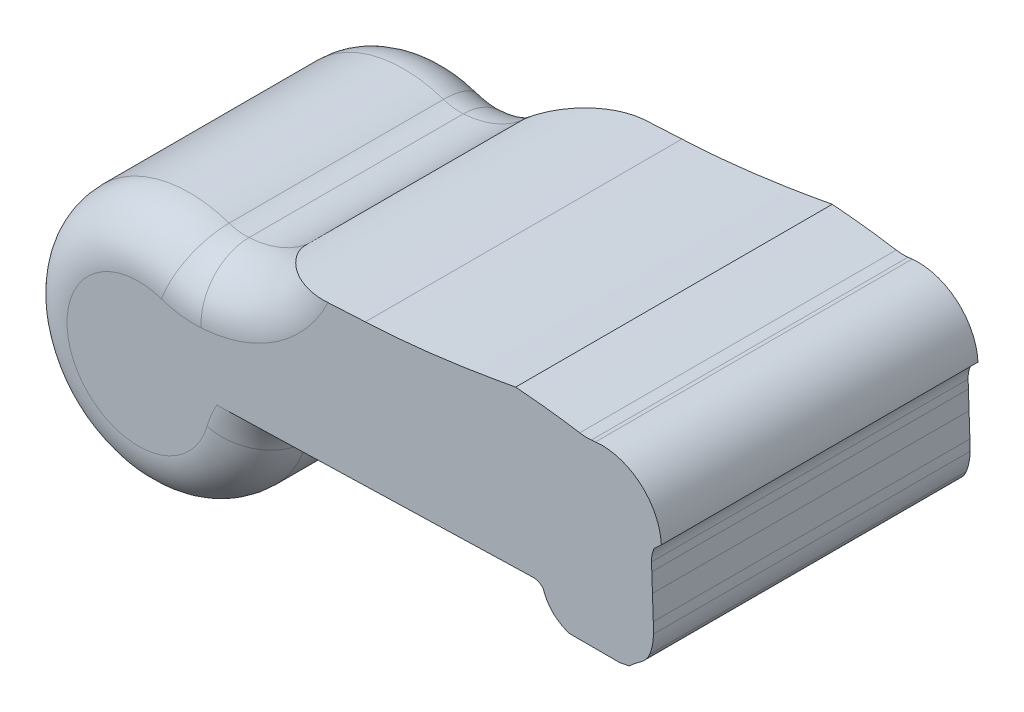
SolidWorks part; units mm, degrees
ref_plane "Front Plane" through (0, 0, 0) normal (0, 0, 1) x (1, 0, 0)
ref_plane "Top Plane" through (0, 0, 0) normal (0, 1, 0) x (1, 0, 0)
ref_plane "Right Plane" through (0, 0, 0) normal (1, 0, 0) x (0, 0, -1)
ref_plane "Plane1" through (0, 0, 7.62) normal (0, 0, 1) x (1, 0, 0)
ref_plane "Plane2" through (0, 0, -228.22) normal (0, 0, -1) x (-1, 0, 0)
sketch "Sketch2" plane through (0, 0, 7.62) normal (0, 0, 1) x (1, 0, 0)
  circle A0 centre (0, 0) radius 91.296
extrude "Extrude1" add sketch "Sketch2" against normal up to surface (235.84 mm away)
sketch "Sketch3" plane through (0, 0, 7.62) normal (0, 0, 1) x (1, 0, 0)
  line L0 (337.4049, 119.4869) -> (340.4943, 119.8116)
  line L1 (125.2878, 4.4564) -> (293.9551, 9.1976)
  line L2 (377.377, -2.3738) -> (378.2104, -1.4436)
  line L7 (382.4039, 56.9698) -> (382.1846, 63.25)
  line L8 (358.444, -13.5754) -> (365.5539, -12.1893)
  line L9 (358.444, -13.5754) -> (321.3285, -13.5754)
  line L10 (383.5078, 25.3591) -> (382.8824, 43.2663)
  line L11 (384.0605, 72.8645) -> (389.5426, 77.8659)
  arc A0 (34.7429, 84.4268) -> (87.2982, 101.526) centre (39.3922, 159.4525) ccw
  arc A1 (34.7429, 84.4268) -> (87.7319, -25.2602) centre (0, 0) cw
  arc A6 (301.4304, 5.8399) -> (293.9551, 9.1976) centre (293.9551, -0.8024) ccw
  arc A10 (125.2878, 4.4564) -> (87.7319, -25.2602) centre (127.2756, -36.6458) ccw
  circle A11 centre (0, 0) radius 91.296 construction
  arc A13 (301.4304, 5.8399) -> (321.3285, -13.5754) centre (329.3425, 14.542) ccw
  ellipse E1 centre (345.0241, 75.4611) end of major axis (374.318, 109.1598) minor radius 44.52 (389.5426, 77.8659) -> (340.4943, 119.8116) ccw
  spline S2 degree 3 poles (169, 111.5051) (174.6177, 111.7605) (180.2194, 112.0931) (188.5979, 112.7004) (191.3882, 112.9209) (196.9545, 113.3961) (199.7269, 113.6504) (205.2499, 114.1903) (208.0004, 114.4759) (213.4785, 115.076) (216.2088, 115.3909) (224.3423, 116.3728) (229.6818, 117.0762) (236.2331, 117.9996) (237.5371, 118.1865) (240.1319, 118.5642) (241.4223, 118.7549) (245.2594, 119.3302) (247.7765, 119.7186) (251.4802, 120.3042) (252.7028, 120.4998) (255.1214, 120.8913) (256.3179, 121.0872) (259.8466, 121.6708) (262.1241, 122.0555) (265.3979, 122.6178) (266.4645, 122.8026) (268.5202, 123.1615) (269.5122, 123.336) (272.3667, 123.8414) (274.1106, 124.1546) (276.0178, 124.5002) (276.3854, 124.567) (277.0901, 124.6952) (277.4275, 124.7568) (278.3752, 124.93) (278.9264, 125.0312) (279.85, 125.2011) (280.2225, 125.2699) (280.6288, 125.345) (280.738, 125.3651) (280.901, 125.3953) (280.9552, 125.4053) (280.9815, 125.4102) knots 0 0 0 0 0.125 0.125 0.1875 0.1875 0.25 0.25 0.3125 0.3125 0.375 0.375 0.5 0.5 0.53125 0.53125 0.5625 0.5625 0.625 0.625 0.65625 0.65625 0.6875 0.6875 0.75 0.75 0.78125 0.78125 0.8125 0.8125 0.875 0.875 0.890625 0.890625 0.90625 0.90625 0.9375 0.9375 0.96875 0.96875 0.984375 0.984375 1 1 1 1
  spline S3 degree 3 poles (87.2982, 101.526) (87.3602, 101.5501) (87.6295, 101.6559) (88.3211, 101.9119) (88.5998, 102.0133) (89.2515, 102.2427) (89.6259, 102.3712) (90.8638, 102.7802) (91.8462, 103.0856) (93.5251, 103.5618) (94.1191, 103.7237) (95.3728, 104.0505) (96.0334, 104.2156) (98.1036, 104.7097) (99.5878, 105.0344) (102.7386, 105.6633) (104.4087, 105.9681) (107.874, 106.5477) (109.6735, 106.8235) (112.4626, 107.217) (113.4084, 107.345) (115.322, 107.5937) (116.29, 107.7145) (119.2256, 108.0668) (121.2249, 108.2882) (125.3006, 108.708) (127.3737, 108.9059) (131.5675, 109.2797) (133.6908, 109.4559) (137.9871, 109.7898) (140.1538, 109.9471) (144.5174, 110.2445) (146.7166, 110.3847) (151.1398, 110.6496) (153.3578, 110.7739) (160.0303, 111.1246) (164.5031, 111.3289) (169, 111.5051) knots 0 0 0 0 0.0625 0.0625 0.09375 0.09375 0.125 0.125 0.1875 0.1875 0.21875 0.21875 0.25 0.25 0.3125 0.3125 0.375 0.375 0.4375 0.4375 0.46875 0.46875 0.5 0.5 0.5625 0.5625 0.625 0.625 0.6875 0.6875 0.75 0.75 0.8125 0.8125 0.875 0.875 1 1 1 1
  spline S5 degree 3 poles (280.9815, 125.4102) (288.9468, 124.7777) (296.906, 124.0156) (312.8089, 122.1621) (320.7527, 121.0727) (328.6856, 119.7533) knots 0 0 0 0 0.5 0.5 1 1 1 1
  spline S14 degree 3 poles (328.6856, 119.7533) (330.1328, 119.5126) (331.5831, 119.3705) (334.4895, 119.281) (335.9457, 119.3336) (337.4049, 119.4869) knots 0 0 0 0 0.5 0.5 1 1 1 1
  spline S15 degree 3 poles (384.0605, 72.8645) (383.9376, 72.5909) (383.8124, 72.2934) (383.567, 71.6662) (383.4463, 71.3354) (383.2123, 70.6391) (383.0991, 70.2735) (382.8841, 69.5057) (382.7819, 69.101) (382.5071, 67.8602) (382.3633, 66.9911) (382.2289, 65.619) (382.1977, 65.1475) (382.1674, 64.2028) (382.1679, 63.7278) (382.1846, 63.25) knots 0 0 0 0 0.125 0.125 0.25 0.25 0.375 0.375 0.5 0.5 0.75 0.75 0.875 0.875 1 1 1 1
  spline S16 degree 3 poles (382.8824, 43.2663) (382.8426, 44.4083) (382.8095, 45.5505) (382.7474, 47.835) (382.7187, 48.9773) (382.6428, 51.2615) (382.5926, 52.403) (382.4924, 54.6861) (382.4438, 55.8278) (382.4039, 56.9698) knots 0 0 0 0 0.25 0.25 0.5 0.5 0.75 0.75 1 1 1 1
  spline S17 degree 3 poles (380.8393, 2.94) (380.5144, 2.1255) (380.1274, 1.3572) (379.4668, 0.2624) (379.2331, -0.0929) (378.7394, -0.7847) (378.4798, -1.1205) (378.2104, -1.4436) knots 0 0 0 0 0.5 0.5 0.75 0.75 1 1 1 1
  spline S18 degree 3 poles (377.377, -2.3738) (376.2076, -3.5895) (375.0004, -4.6557) (373.7299, -5.5765) knots 0 0 0 0 1 1 1 1
  spline S19 degree 3 poles (373.7299, -5.5765) (372.335, -6.5875) (370.9301, -7.6243) (368.1757, -9.8046) (366.8256, -10.9474) (365.5539, -12.1893) knots 0 0 0 0 0.5 0.5 1 1 1 1
  spline S20 degree 3 poles (380.8393, 2.94) (381.764, 5.2586) (382.4532, 7.6228) (383.3853, 12.4376) (383.6282, 14.8882) (383.6361, 17.3843) knots 0 0 0 0 0.5 0.5 1 1 1 1
  spline S21 degree 3 poles (383.6361, 17.3843) (383.6445, 20.0434) (383.6006, 22.7016) (383.5078, 25.3591) knots 0 0 0 0 1 1 1 1
extrude "Extrude2" add sketch "Sketch3" against normal up to surface (235.84 mm away)
fillet "Fillet1" radius 38.1 7 edges at (62.6491, 87.9712, -228.22) (101.7416, -4.3758, -228.22) (101.7416, -4.3758, 7.62) (-82.206, -39.7131, -228.22) (34.7429, 84.4268, -110.3) (-82.206, -39.7131, 7.62)
